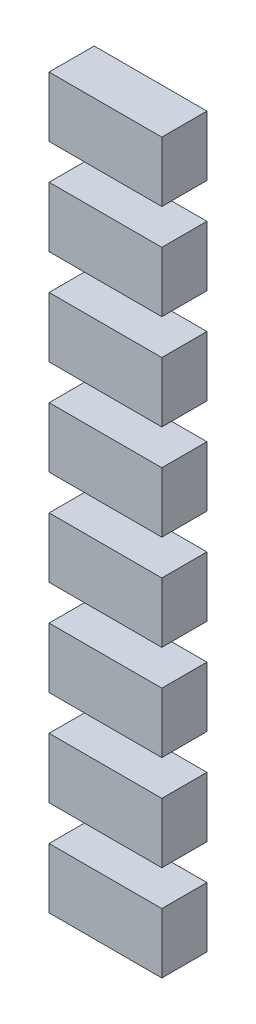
SolidWorks part; units mm, degrees
ref_plane "前视基准面" through (0, 0, 0) normal (0, 0, 1) x (1, 0, 0)
ref_plane "上视基准面" through (0, 0, 0) normal (0, 1, 0) x (1, 0, 0)
ref_plane "右视基准面" through (0, 0, 0) normal (1, 0, 0) x (0, 0, -1)
other "Configuration Table"
sketch "草图1" plane through (0, 0, 0) normal (0, 0, 1) x (1, 0, 0)
  line L0 (28, -33.244) -> (31, -33.244)
  line L1 (31, -33.244) -> (31, -31.644)
  line L2 (31, -31.644) -> (28, -31.644)
  line L3 (28, -31.644) -> (28, -33.244)
  line L4 (28, -30.704) -> (31, -30.704)
  line L5 (31, -30.704) -> (31, -29.104)
  line L6 (31, -29.104) -> (28, -29.104)
  line L7 (28, -29.104) -> (28, -30.704)
  line L8 (28, -28.164) -> (31, -28.164)
  line L9 (31, -28.164) -> (31, -26.564)
  line L10 (31, -26.564) -> (28, -26.564)
  line L11 (28, -26.564) -> (28, -28.164)
  line L12 (28, -25.624) -> (31, -25.624)
  line L13 (31, -25.624) -> (31, -24.024)
  line L14 (31, -24.024) -> (28, -24.024)
  line L15 (28, -24.024) -> (28, -25.624)
  line L16 (28, -20.544) -> (31, -20.544)
  line L17 (31, -20.544) -> (31, -18.944)
  line L18 (31, -18.944) -> (28, -18.944)
  line L19 (28, -18.944) -> (28, -20.544)
  line L20 (28, -18.004) -> (31, -18.004)
  line L21 (31, -18.004) -> (31, -16.404)
  line L22 (31, -16.404) -> (28, -16.404)
  line L23 (28, -16.404) -> (28, -18.004)
  line L24 (28, -23.084) -> (31, -23.084)
  line L25 (31, -23.084) -> (31, -21.484)
  line L26 (31, -21.484) -> (28, -21.484)
  line L27 (28, -21.484) -> (28, -23.084)
  line L28 (28, -15.464) -> (31, -15.464)
  line L29 (31, -15.464) -> (31, -13.864)
  line L30 (31, -13.864) -> (28, -13.864)
  line L31 (28, -13.864) -> (28, -15.464)
  dimension "D1" = 28
  dimension "D2" = 31
  dimension "D3" = 13.864
  dimension "D4" = 15.464
  dimension "D5" = 16.404
  dimension "D6" = 18.944
  dimension "D7" = 21.484
  dimension "D8" = 24.024
  dimension "D9" = 26.564
  dimension "D10" = 29.104
  dimension "D11" = 31.644
extrude "Eight_front_resistor_clearance_envelopes" add sketch "草图1" along normal blind 1.2 from offset 1.2 separate body
